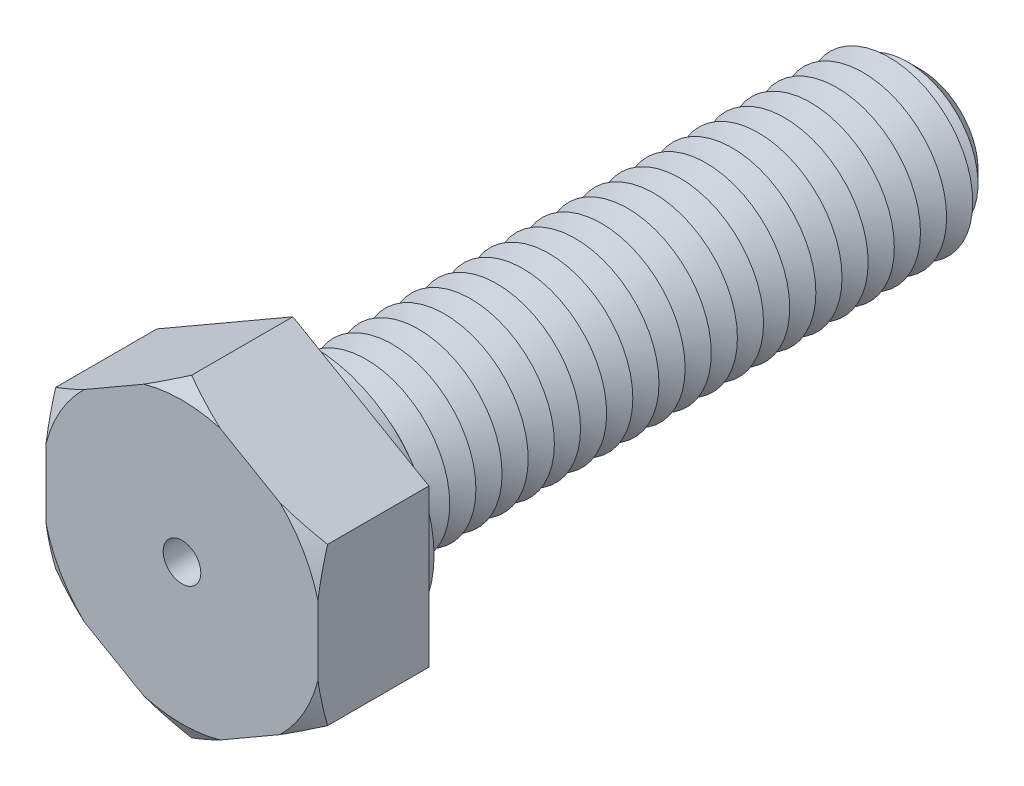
SolidWorks part; units mm, degrees
ref_plane "Front Plane" through (0, 0, 0) normal (0, 0, 1) x (1, 0, 0)
ref_plane "Top Plane" through (0, 0, 0) normal (0, 1, 0) x (1, 0, 0)
ref_plane "Right Plane" through (0, 0, 0) normal (1, 0, 0) x (0, 0, -1)
sketch "Sketch2" plane through (0, 0, 0) normal (0, 0, 1) x (1, 0, 0)
  line L1 (0, 7.5056) -> (-6.5, 3.7528)
  line L2 (-6.5, 3.7528) -> (-6.5, -3.7528)
  line L3 (-6.5, -3.7528) -> (0, -7.5056)
  line L4 (0, -7.5056) -> (6.5, -3.7528)
  line L5 (6.5, -3.7528) -> (6.5, 3.7528)
  line L6 (6.5, 3.7528) -> (0, 7.5056)
  circle A0 centre (0, 0) radius 6.5 construction
  dimension "D1" = 13
extrude "Boss-Extrude1" add sketch "Sketch2" along normal blind 5.3
sketch "Sketch3" plane through (0, 0, 0) normal (0, 0, -1) x (-1, 0, 0)
  circle A0 centre (0, 0) radius 4
  dimension "D1" = 8
extrude "Boss-Extrude2" add sketch "Sketch3" along normal blind 30
sketch "Sketch4" plane through (0, 0, 0) normal (0, 0, -1) x (-1, 0, 0)
  circle A0 centre (0, 0) radius 5.75
  dimension "D1" = 11.5
extrude "Boss-Extrude3" add sketch "Sketch4" along normal blind 1
sketch "Sketch5" plane through (0, 0, 0) normal (1, 0, 0) x (0, 0, -1)
  line L0 (-3.2117, 0) -> (6.3192, 0) construction
chamfer "Chamfer1" distance 1.25 angle 45 1 edges at (-4, 0, -30)
sketch "Sketch6" plane through (0, 0, 0) normal (1, 0, 0) x (0, 0, -1)
  line L0 (1, 4) -> (1.625, 2.9175)
  line L1 (1.625, 2.9175) -> (2.25, 4)
  line L2 (28.75, 4) -> (1, 4) construction
  line L3 (2.25, 4) -> (1, 4)
  dimension "D1" = 1.25
revolve "Cut-Revolve1" cut sketch "Sketch6" angle 360 about L0
pattern_linear "LPattern1" count 23 spacing 1.25 along (0, 0, -1) of "Cut-Revolve1"
sketch "Sketch7" plane through (0, 0, 0) normal (1, 0, 0) x (0, 0, -1)
  line L0 (-5.3, 7.5056) -> (-5.3, 6.7056)
  line L1 (-5.3, 3.7528) -> (-5.3, 7.5056) construction
  line L2 (-5.3, 6.7056) -> (-4.8381, 7.5056)
  line L3 (-5.3, 7.5056) -> (0, 7.5056) construction
  line L4 (-4.8381, 7.5056) -> (-5.3, 7.5056)
  dimension "D1" = 0.8
  dimension "D2" = 30
revolve "Cut-Revolve2" cut sketch "Sketch7" angle 360 about L0
sketch "Sketch8" plane through (0, 0, 5.3) normal (0, 0, 1) x (1, 0, 0)
  circle A0 centre (0, 0) radius 0.9
  dimension "D1" = 1.8
extrude "Cut-Extrude1" cut sketch "Sketch8" against normal up to surface (35.3 mm away)
